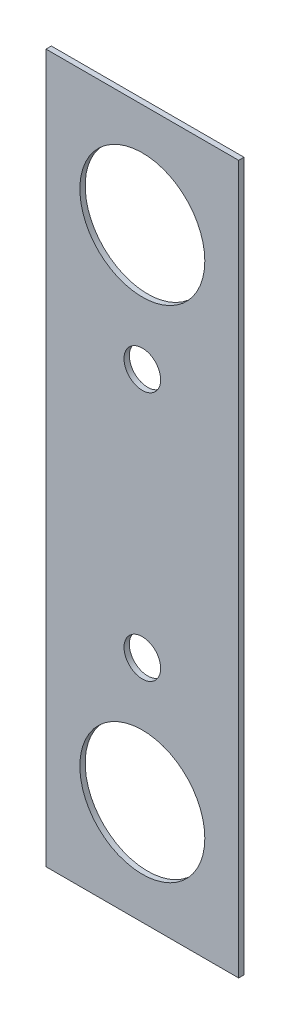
SolidWorks part; units mm, degrees
ref_plane "Front" through (0, 0, 0) normal (0, 0, 1) x (1, 0, 0)
ref_plane "Top" through (0, 0, 0) normal (0, 1, 0) x (1, 0, 0)
ref_plane "Right" through (0, 0, 0) normal (1, 0, 0) x (0, 0, -1)
sketch "Sketch1" plane through (0, 0, 0) normal (0, 0, 1) x (1, 0, 0)
  line L0 (-14.6844, 0) -> (14.6844, 0) construction
  line L8 (14.6844, -53.975) -> (14.6844, 53.975)
  line L9 (14.6844, 53.975) -> (-14.6844, 53.975)
  line L10 (-14.6844, 53.975) -> (-14.6844, -53.975)
  line L11 (-14.6844, -53.975) -> (14.6844, -53.975)
  circle A2 centre (0, -38.1) radius 9.525
  circle A3 centre (0, 38.1) radius 9.525
  circle A4 centre (0, 19.05) radius 2.794
  circle A5 centre (0, -19.05) radius 2.794
other "AlignGroup1" parameters "D2"=8.6451, "D10"=19.05, "D1"=29.3688, "D3"=107.95, "D4"=107.95, "D5"=0, "D6"=15.875, "D7"=34.925, "D8"=73.025, "D9"=92.075
extrude "Boss-Extrude1" add sketch "Sketch1" along normal blind 0.8128
